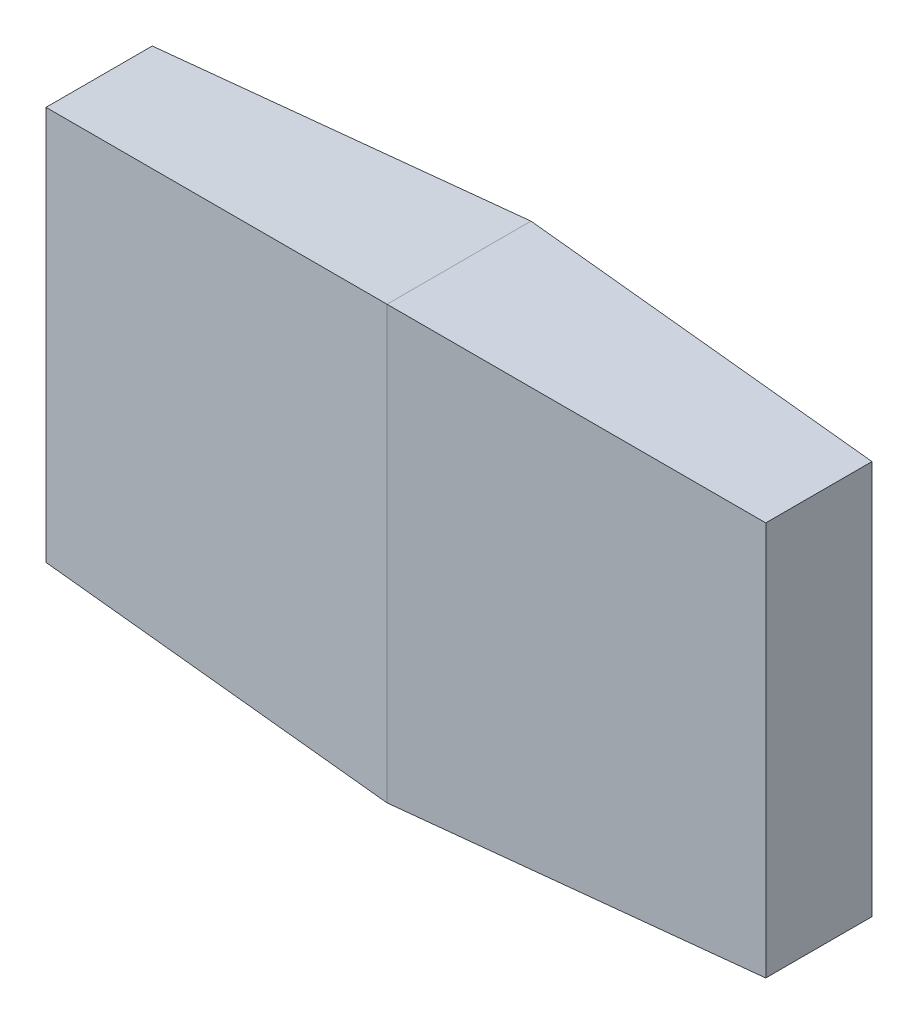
SolidWorks part; units mm, degrees
ref_plane "Ebene vorne" through (0, 0, 0) normal (0, 0, 1) x (1, 0, 0)
ref_plane "Ebene oben" through (0, 0, 0) normal (0, 1, 0) x (1, 0, 0)
ref_plane "Ebene rechts" through (0, 0, 0) normal (1, 0, 0) x (0, 0, -1)
sketch "Skizze1" plane through (0, 0, 0) normal (0, 0, 1) x (1, 0, 0)
  line L0 (50, 30) -> (-50, -30) construction
  line L1 (-50, 30) -> (50, 30)
  line L2 (-50, 30) -> (-50, -30)
  line L3 (-50, -30) -> (50, -30)
  line L4 (50, 30) -> (50, -30)
  dimension "D1" = 60
  dimension "D2" = 100
extrude "Linear austragen1" add sketch "Skizze1" along normal mid plane 20
sketch "Skizze2" plane through (0, 0, 0) normal (0, 0, 1) x (1, 0, 0)
  line L0 (0, 64.8814) -> (0, -57.7833)
draft "Formschräge1" type of draft neutral plane draft angle 3 neutral plane "Ebene rechts" faces to draft 4 parameters "D1"=3
draft "Formschräge2" type of draft neutral plane draft angle 3 neutral plane "Ebene rechts" faces to draft 4 parameters "D1"=3
